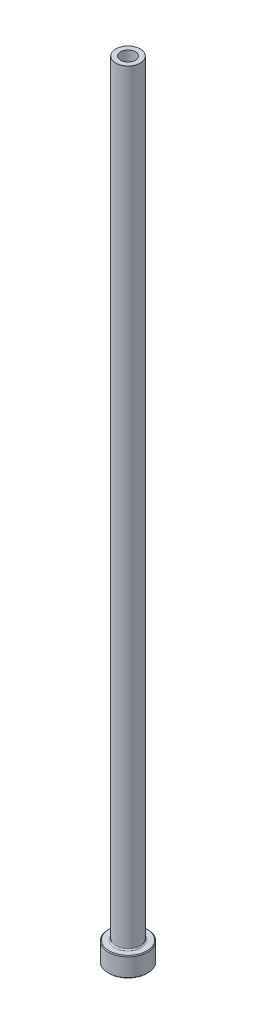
SolidWorks part; units mm, degrees
ref_plane "Front Plane" through (0, 0, 0) normal (0, 0, 1) x (1, 0, 0)
ref_plane "Top Plane" through (0, 0, 0) normal (0, 1, 0) x (1, 0, 0)
ref_plane "Right Plane" through (0, 0, 0) normal (1, 0, 0) x (0, 0, -1)
sketch "Sketch1" plane through (0, 0, 0) normal (0, 0, 1) x (1, 0, 0)
  line L0 (0, 0) -> (0, 50000) construction
  line L1 (0, 0) -> (6.35, 0)
  line L2 (6.35, 0) -> (6.35, 6.35)
  line L3 (6.35, 6.35) -> (4.3593, 6.35)
  line L4 (3.9624, 6.7469) -> (3.9624, 254)
  line L5 (3.9624, 254) -> (0, 254)
  line L6 (0, 254) -> (0, 0)
  arc A0 (3.9624, 6.7469) -> (4.3593, 6.35) centre (4.3593, 6.7469) ccw
  dimension "D5" = 0.3969
  dimension "D1" = 7.9248
  dimension "D2" = 12.7
  dimension "D3" = 6.35
  dimension "D4" = 254
revolve "Revolve1" add sketch "Sketch1" angle 360 about L0
sketch "Sketch2" plane through (0, 0, 0) normal (0, 0, 1) x (1, 0, 0)
  line L0 (0, 0) -> (0, 50000) construction
  line L1 (-6.35, 0) -> (6.35, 0) construction
  line L2 (2.9686, 0) -> (2.5717, 0.3969)
  line L3 (2.5717, 0.3969) -> (2.5718, 179.5145)
  line L4 (2.5718, 179.5145) -> (2.3813, 193.802)
  line L5 (2.3813, 193.802) -> (2.3813, 254)
  line L6 (3.9624, 254) -> (-3.9624, 254) construction
  line L7 (2.3813, 254) -> (0, 254)
  line L8 (0, 254) -> (0, 0)
  line L9 (0, 0) -> (2.9686, 0)
  point P4 (0, 0)
  dimension "D1" = 0.3969
  dimension "D2" = 45
  dimension "D3" = 4.7625
  dimension "D4" = 5.1435
  dimension "D5" = 60.198
  dimension "D6" = 14.2875
revolve "Cut-Revolve1" cut sketch "Sketch2" angle 360 about L0
chamfer "Chamfer1" distance 0.254 angle 45 2 edges at (0, 0, -6.35) (0, 6.35, -6.35)
